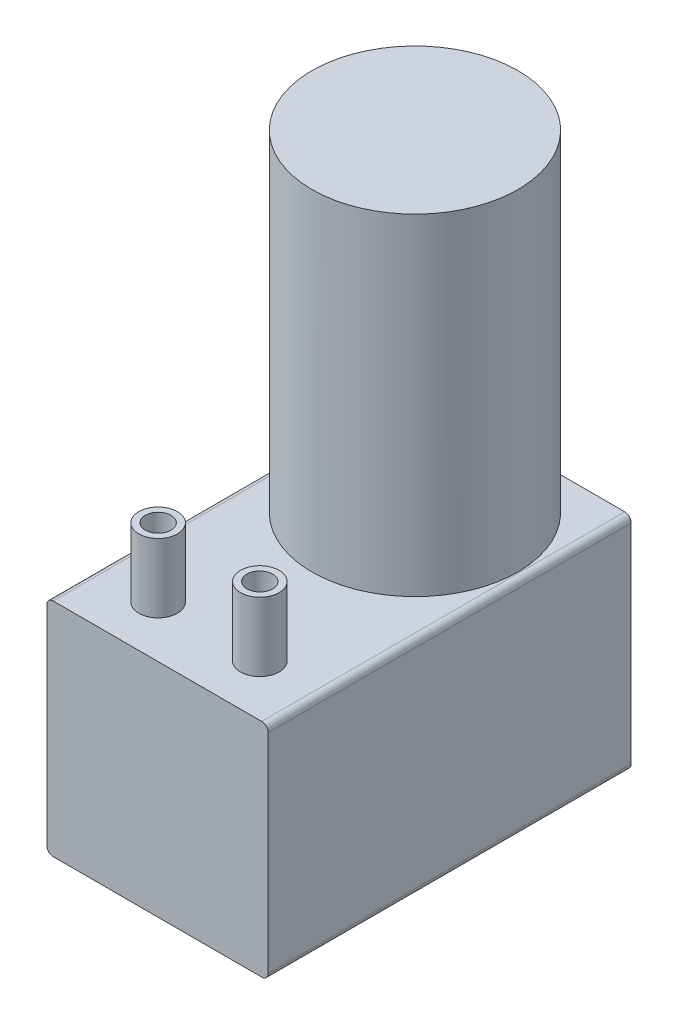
SolidWorks part; units mm, degrees
ref_plane "Front Plane" through (0, 0, 0) normal (0, 0, 1) x (1, 0, 0)
ref_plane "Top Plane" through (0, 0, 0) normal (0, 1, 0) x (1, 0, 0)
ref_plane "Right Plane" through (0, 0, 0) normal (1, 0, 0) x (0, 0, -1)
sketch "Sketch1" plane through (0, 0, 0) normal (0, 0, 1) x (1, 0, 0)
  line L1 (0, 0) -> (17.2, 0)
  line L2 (0, 0) -> (0, 17.2)
  line L3 (0, 17.2) -> (17.2, 17.2)
  line L4 (17.2, 0) -> (17.2, 17.2)
  dimension "D1" = 17.2
  dimension "D2" = 17.2
extrude "Extrude1" add sketch "Sketch1" along normal blind 28.2
sketch "Sketch2" plane through (0, 17.2, 0) normal (0, 1, 0) x (-1, 0, 0)
  line L0 (-17.2, 0) -> (0, 0) construction
  line L1 (-8.6, 28.2) -> (-8.6, 0) construction
  line L2 (-17.2, 28.2) -> (0, 28.2) construction
  circle A0 centre (-8.6, 8.2) radius 8
  dimension "D1" = 8.2
extrude "Extrude2" add sketch "Sketch2" along normal blind 25.73
sketch "Sketch3" plane through (0, 17.2, 0) normal (0, 1, 0) x (-1, 0, 0)
  line L0 (-17.2, 28.2) -> (-17.2, 0) construction
  line L1 (0, 28.2) -> (0, 0) construction
  line L2 (-17.2, 28.2) -> (0, 28.2) construction
  circle A0 centre (-12.55, 24.2) radius 1.5
  circle A1 centre (-4.65, 24.2) radius 1.5
  dimension "D1" = 4.65
  dimension "D2" = 4.65
  dimension "D3" = 4
  dimension "D4" = 4
extrude "Extrude3" add sketch "Sketch3" along normal blind 5.34
sketch "Sketch4" plane through (0, 22.54, 0) normal (0, 1, 0) x (-1, 0, 0)
  circle A0 centre (-12.55, 24.2) radius 1
  circle A1 centre (-4.65, 24.2) radius 1
extrude "Cut-Extrude1" cut sketch "Sketch4" against normal up to surface (5.34 mm away)
fillet "Fillet1" radius 0.5 1 edges at (0, 17.2, 14.1)
fillet "Fillet2" radius 0.5 1 edges at (17.2, 17.2, 14.1)
fillet "Fillet3" radius 0.5 1 edges at (17.2, 0, 14.1)
fillet "Fillet4" radius 0.5 1 edges at (0, 0, 14.1)
